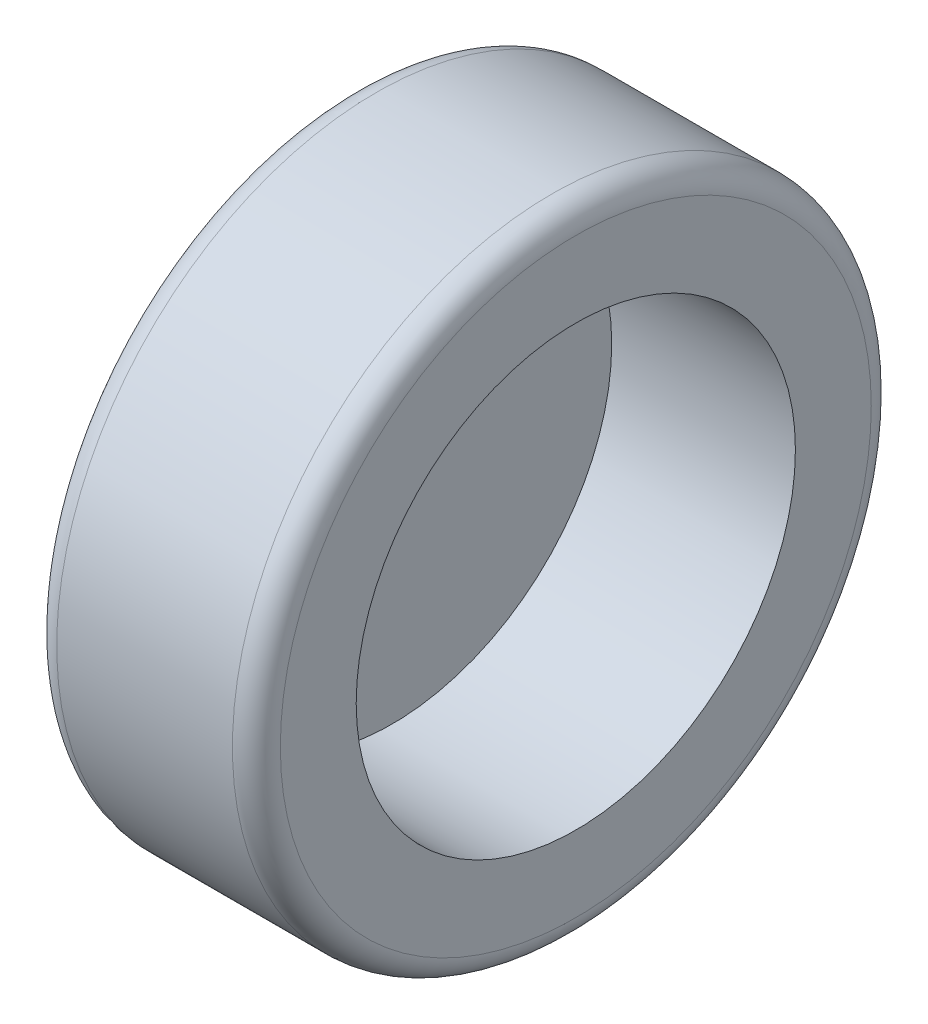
SolidWorks part; units mm, degrees
ref_plane "Plan de face" through (0, 0, 0) normal (0, 0, 1) x (1, 0, 0)
ref_plane "Plan de dessus" through (0, 0, 0) normal (0, 1, 0) x (1, 0, 0)
ref_plane "Plan de droite" through (0, 0, 0) normal (1, 0, 0) x (0, 0, -1)
sketch "Esquisse1" plane through (0, 0, 0) normal (1, 0, 0) x (0, 0, -1)
  circle A0 centre (0, 0) radius 400
  circle A1 centre (0, 0) radius 275
  dimension "D1" = 800
  dimension "D2" = 550
extrude "Boss.-Extru.1" add sketch "Esquisse1" along normal mid plane 280
sketch "Esquisse3" plane through (-140, 0, 0) normal (-1, 0, 0) x (0, 0, 1)
  circle A0 centre (0, 0) radius 326.9956
  circle A1 centre (0, 0) radius 5
extrude "Boss.-Extru.3" add sketch "Esquisse3" against normal blind 50
fillet "Congé1" radius 30 2 edges at (140, 0, -400) (-140, 0, -400)
